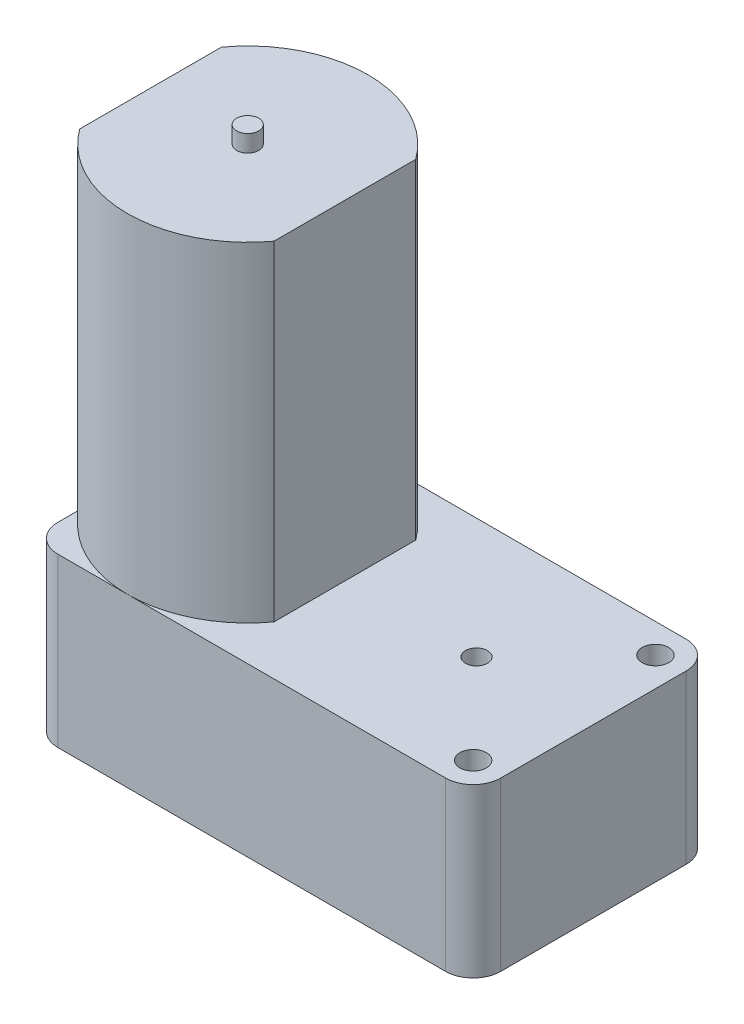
SolidWorks part; units mm, degrees
ref_plane "Front Plane" through (0, 0, 0) normal (0, 0, 1) x (1, 0, 0)
ref_plane "Top Plane" through (0, 0, 0) normal (0, 1, 0) x (1, 0, 0)
ref_plane "Right Plane" through (0, 0, 0) normal (1, 0, 0) x (0, 0, -1)
sketch "Sketch1" plane through (0, 0, 0) normal (0, 1, 0) x (1, 0, 0)
  line L1 (-20.9, 11.35) -> (20.9, 11.35)
  line L2 (-20.9, 11.35) -> (-20.9, -11.35)
  line L3 (-20.9, -11.35) -> (20.9, -11.35)
  line L4 (20.9, 11.35) -> (20.9, -11.35)
  point P4 (20.9, 0)
  point P6 (0, -11.35)
  dimension "D1" = 41.8
  dimension "D2" = 22.7
extrude "Boss-Extrude1" add sketch "Sketch1" along normal blind 15.81
sketch "Sketch2" plane through (0, 0, 0) normal (0, -1, 0) x (1, 0, 0)
  line L0 (-20.9, 0) -> (20.9, 0) construction
  line L1 (-20.9, -11.35) -> (-20.9, 11.35) construction
  line L2 (20.9, 11.35) -> (20.9, -11.35) construction
  line L3 (20.9, -11.35) -> (-20.9, -11.35) construction
  circle A0 centre (18.15, 8.6) radius 1.25
  circle A1 centre (18.15, -8.6) radius 1.25
  circle A2 centre (9.86, 0) radius 1.04
  dimension "D1" = 2.5
  dimension "D4" = 2.08
  dimension "D2" = 17.2
  dimension "D3" = 39.05
  dimension "D5" = 30.76
  dimension "D6" = 11.35
extrude "Cut-Extrude1" cut sketch "Sketch2" against normal through all
fillet "Fillet1" radius 2.6 4 edges at (-20.9, 7.905, 11.35) (-20.9, 7.905, -11.35) (20.9, 7.905, -11.35) (20.9, 7.905, 11.35)
sketch "Sketch3" plane through (0, 0, 0) normal (0, -1, 0) x (1, 0, 0)
  line L0 (-20.9, -8.75) -> (-20.9, 8.75) construction
  circle A0 centre (-1.39, 0) radius 1.97
  dimension "D1" = 3.94
  dimension "D2" = 19.51
extrude "Boss-Extrude2" add sketch "Sketch3" along normal blind 1
sketch "Sketch4" plane through (0, 15.81, 0) normal (0, 1, 0) x (1, 0, 0)
  line L0 (18.3, 11.35) -> (-18.3, 11.35) construction
  line L1 (-20.9, 6.6883) -> (-20.9, -6.6883)
  line L2 (-20.9, 8.75) -> (-20.9, -8.75) construction
  line L3 (-11.73, 11.35) -> (-11.73, -11.9297) construction
  line L4 (-2.56, 6.6883) -> (-2.56, -6.6883)
  arc A0 (-20.9, -6.6883) -> (-2.56, -6.6883) centre (-11.73, 0) ccw
  arc A1 (-2.56, 6.6883) -> (-20.9, 6.6883) centre (-11.73, 0) ccw
  dimension "D1" = 18.34
extrude "Boss-Extrude3" add sketch "Sketch4" along normal blind 31.12 separate body
sketch "Sketch5" plane through (0, 46.93, 0) normal (0, 1, 0) x (-1, 0, 0)
  circle A0 centre (11.73, 0) radius 1.04
  arc A1 (2.56, -6.6883) -> (20.9, -6.6883) centre (11.73, 0) ccw construction
  dimension "D1" = 2.08
extrude "Boss-Extrude4" add sketch "Sketch5" along normal blind 1.6
